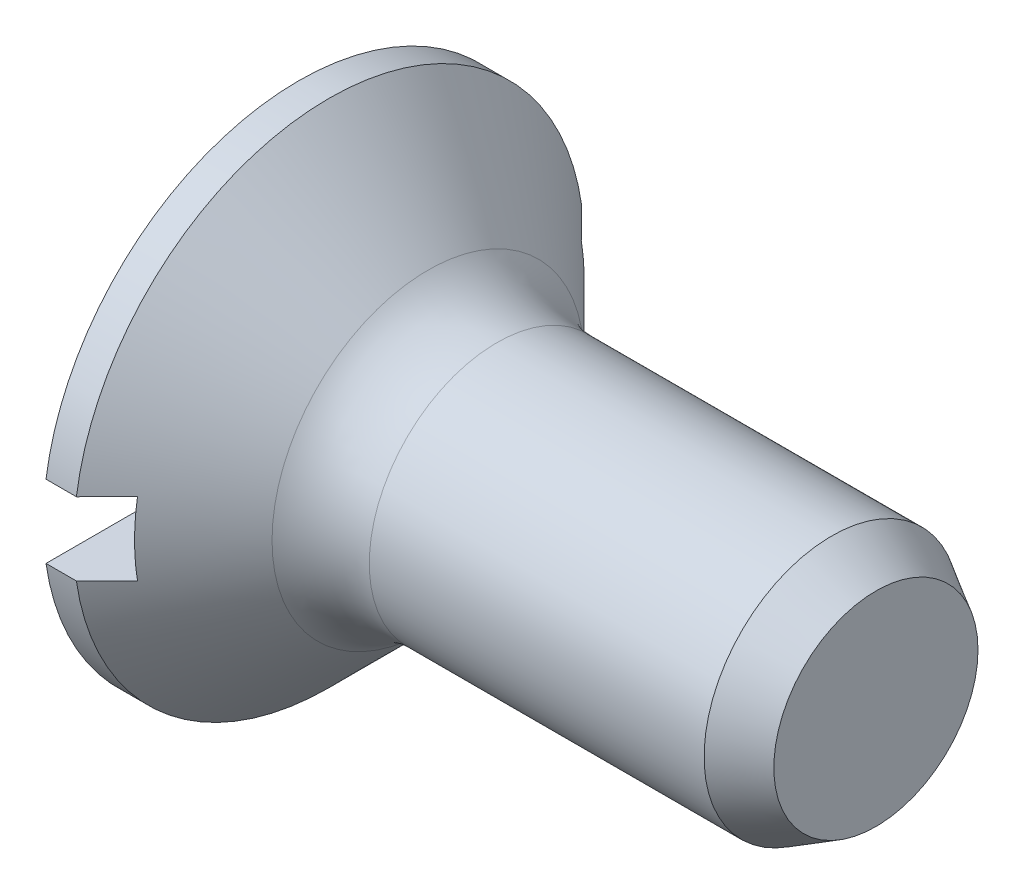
SolidWorks part; units mm, degrees
ref_plane "Front" through (0, 0, 0) normal (0, 0, 1) x (1, 0, 0)
ref_plane "Top" through (0, 0, 0) normal (0, 1, 0) x (1, 0, 0)
ref_plane "Right" through (0, 0, 0) normal (1, 0, 0) x (0, 0, -1)
sketch "Sketch1" plane through (0, 0, 0) normal (0, 0, 1) x (1, 0, 0)
  line L0 (0, 4.2) -> (0.5, 4.2)
  line L1 (0.5, 4.2) -> (2.6, 2.1)
  line L2 (2.6, 2.1) -> (9.5, 2.1)
  line L3 (9.5, 2.1) -> (9.5, 0)
  line L4 (9.5, 0) -> (0, 0)
  line L5 (0, 0) -> (0, 4.2)
  line L6 (6.6207, 0) -> (-0.9387, 0) construction
revolve "Revolve1" add sketch "Sketch1" angle 360 about L6
sketch "Sketch2" plane through (0, 0, 0) normal (0, 0, 1) x (1, 0, 0)
  line L0 (0, 4.2) -> (0, -4.2) construction
  line L1 (0, 0.6) -> (1, 0.6)
  line L2 (0, 0.6) -> (0, -0.6)
  line L3 (0, -0.6) -> (1, -0.6)
  line L4 (1, 0.6) -> (1, -0.6)
  dimension "n" = 1.2
  dimension "t" = 1
extrude "Cut-Extrude1" cut sketch "Sketch2" against normal through all and the other way through all
chamfer "Chamfer1" distance 0.42 angle 60 1 edges at (9.5, 0, -2.1)
sketch "Sketch4" plane through (0, 0, 0) normal (0, 0, 1) x (1, 0, 0)
  line L0 (3.8225, 1.55) -> (3.0575, 1.55)
  line L1 (3.0575, 1.55) -> (2.74, 2.1)
  line L2 (3.8225, 1.55) -> (4.14, 2.1)
  line L3 (2.74, 2.1) -> (2.74, 2.35)
  line L4 (4.14, 2.1) -> (4.14, 2.35)
  line L5 (2.74, 2.35) -> (4.14, 2.35)
  line L6 (3.44, 1.55) -> (3.44, 0) construction
  line L7 (0, 0) -> (7.3035, 0) construction
  line L9 (8.7725, 2.1) -> (2.6, 2.1) construction
  line L12 (2.6, 2.1) -> (2.6, -2.1) construction
revolve "ThreadSchematic" [suppressed] cut sketch "Sketch4" angle 360 about L7
pattern_linear "ThdSchPat" [suppressed] count 5 spacing 1.4 along (-1, 0, 0)
sketch "Sketch3" plane through (0, 0, 0) normal (0, 0, 1) x (1, 0, 0)
  line L0 (2.6, 2.1) -> (9.5, 2.1) construction
  line L2 (5.8, 2.1) -> (6.725, 2.1) construction
  line L3 (9.5, 2.1) -> (9.5, 0) construction
  line L4 (6.725, 2.1) -> (9.5, 0)
  line L5 (2.9, 0) -> (5.4301, 0) construction
  line L6 (9.5, 0) -> (9.7, 0)
  line L7 (9.7, 0) -> (9.7, 2.1)
  line L8 (9.7, 2.1) -> (9.5, 2.1)
  line L9 (6.725, 2.1) -> (9.5, 2.1)
revolve "EndCone" [suppressed] cut sketch "Sketch3" angle 360 about L5
fillet "Fillet1" radius 1.6 1 edges at (2.6, 0, -2.1)
equation "\"minordia@Sketch4\" = \"D2@ThreadCosmetic\""
equation "\"D1@Chamfer1\" = \"d@Sketch1\" / 10"
equation "\"D1@Sketch3\" = \"y@Sketch3\" / 4"
equation "\"threadstart@Sketch4\" = \"advance@Sketch4\"*0.6"
equation "\"D1@ThdSchPat\" = int(((\"l@Sketch1\"-\"k@Sketch1\")/\"advance@Sketch4\") + 0.999)"
equation "\"D3@ThdSchPat\" =\"advance@Sketch4\""
